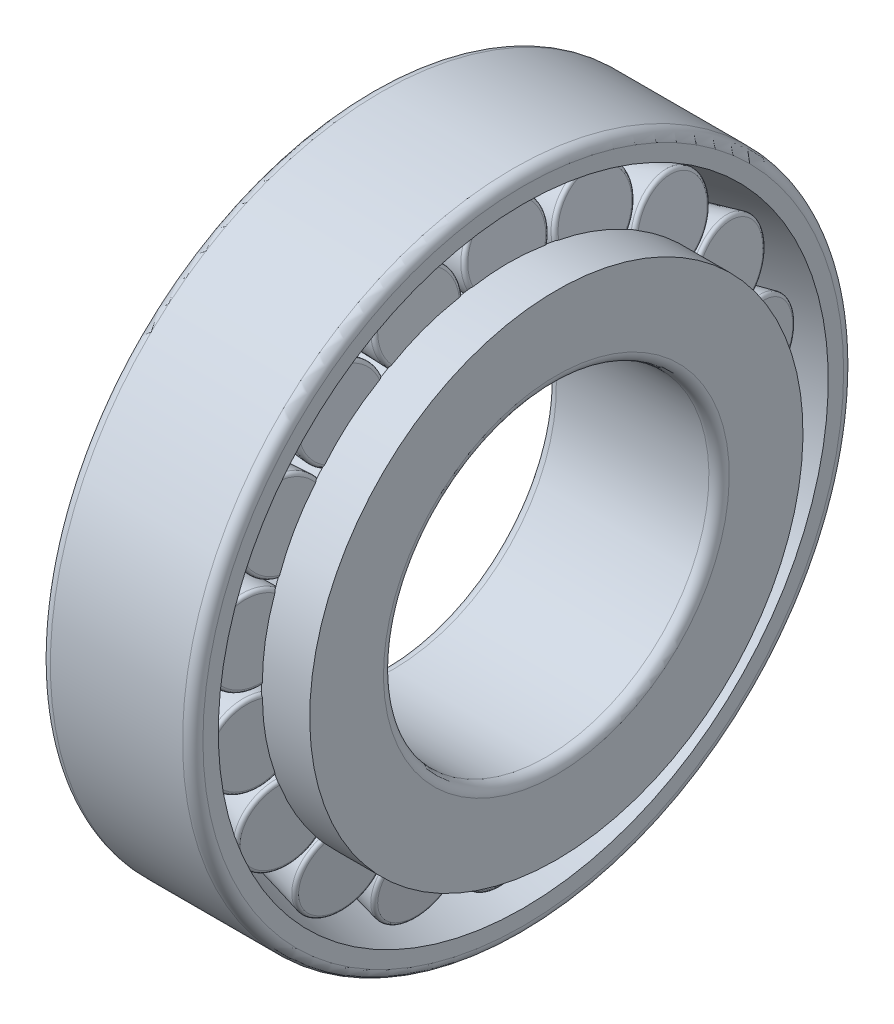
SolidWorks part; units mm, degrees
ref_plane "Front" through (0, 0, 0) normal (0, 0, 1) x (1, 0, 0)
ref_plane "Top" through (0, 0, 0) normal (0, 1, 0) x (1, 0, 0)
ref_plane "Right" through (0, 0, 0) normal (1, 0, 0) x (0, 0, -1)
other "Configuration Table"
sketch "Sketch1" plane through (0, 0, 0) normal (0, 0, 1) x (1, 0, 0)
  line L0 (10.753, 0) -> (13.9916, 0) construction
  line L1 (7.5, 29.9899) -> (7.5, 31.5)
  line L2 (6.5, 32.5) -> (-6.5, 32.5)
  line L3 (-7.5, 31.5) -> (-7.5, 26.25)
  line L4 (-7.5, 26.25) -> (7.5, 29.9899)
  line L5 (-6.247, 17) -> (-6.247, 22.0124)
  line L6 (-5.247, 16) -> (9.753, 16)
  line L7 (10.753, 17) -> (10.753, 24.2704)
  line L8 (-4.3401, 20.5124) -> (-5.3344, 26.79)
  line L9 (6.5, 21.2704) -> (5.2094, 29.4188)
  line L10 (-4.8372, 23.6512) -> (5.8547, 25.3446) construction
  line L11 (-4.3401, 20.5124) -> (6.5, 21.2704)
  line L12 (6.0248, 24.25) -> (10.753, 24.25)
  line L13 (10.753, 24.2704) -> (6.0248, 24.2704)
  line L14 (-6.247, 22.0124) -> (-4.5777, 22.0124)
  arc A0 (-6.5, 32.5) -> (-7.5, 31.5) centre (-6.5, 31.5) ccw
  arc A1 (7.5, 31.5) -> (6.5, 32.5) centre (6.5, 31.5) ccw
  arc A2 (-5.247, 16) -> (-6.247, 17) centre (-5.247, 17) cw
  arc A3 (9.753, 16) -> (10.753, 17) centre (9.753, 17) ccw
  point P19 (-7.5, 32.5)
  point P22 (7.5, 32.5)
  point P24 (0, 32.5)
  point P29 (-6.247, 16)
  point P32 (10.753, 16)
revolve "Revolve1" add sketch "Sketch1" angle 360 about L0
sketch "Sketch2" plane through (0, 0, 0) normal (0, 0, 1) x (1, 0, 0)
  line L0 (-4.857, 23.648) -> (9.3992, 25.906) construction
  line L4 (-4.8372, 23.6512) -> (5.8547, 25.3446) construction
  line L5 (-4.857, 23.648) -> (5.8745, 25.3477)
  line L7 (-5.3541, 26.7868) -> (-4.357, 20.4911)
  line L8 (6.5232, 21.252) -> (5.2292, 29.4219)
  line L9 (-4.357, 20.4911) -> (6.5232, 21.252)
  line L10 (-4.857, 23.648) -> (-4.4043, 20.7898)
  line L11 (6.4668, 21.6077) -> (5.8745, 25.3477)
  line L12 (-4.0553, 20.5122) -> (6.1639, 21.2268)
  arc A0 (-4.0553, 20.5122) -> (-4.4043, 20.7898) centre (-4.0783, 20.8414) cw
  arc A1 (6.1639, 21.2268) -> (6.4668, 21.6077) centre (6.1409, 21.556) ccw
revolve "Revolve2" add sketch "Sketch2" angle 360 about L0
sketch "Sketch3" plane through (0, 0, 0) normal (0, 0, 1) x (1, 0, 0)
  line L0 (-7.5, 26.25) -> (7.5, 29.9899) construction
  line L1 (-7.5, 31.5) -> (-7.5, 26.25) construction
  line L2 (6.5, 32.5) -> (-6.5, 32.5) construction
  line L3 (7.5, 29.9899) -> (7.5, 31.5) construction
  line L4 (-7.5, 26.25) -> (7.5, 29.9899)
  line L5 (-7.5, 31.5) -> (-7.5, 26.25)
  line L6 (6.5, 32.5) -> (-6.5, 32.5)
  line L7 (7.5, 29.9899) -> (7.5, 31.5)
  arc A0 (-6.5, 32.5) -> (-7.5, 31.5) centre (-6.5, 31.5) ccw construction
  arc A1 (7.5, 31.5) -> (6.5, 32.5) centre (6.5, 31.5) ccw construction
  arc A2 (-6.5, 32.5) -> (-7.5, 31.5) centre (-6.5, 31.5) ccw
  arc A3 (7.5, 31.5) -> (6.5, 32.5) centre (6.5, 31.5) ccw
revolve "Revolve3" add sketch "Sketch3" angle 360 about axis through (10.753, 0, 0) along (1, 0, 0)
pattern_circular "Circular-Pattern1" count 18 over 360 about axis through (0, 0, 0) along (1, 0, 0) of "Revolve2"
equation "\"gzzj@Sketch1\" =  ( \"DD@Sketch1\" - \"XD@Sketch1\" )  / 4"
equation "\"D1@Sketch1\" = \"DB@Sketch1\" - \"DT@Sketch1\" / 20"
equation "\"D2@Sketch1\" = \"DT@Sketch1\" - \"DC@Sketch1\" + \"XR12@Sketch1\""
equation "\"D4@Sketch1\" = \"D3@Sketch1\" / 2"
equation "\"D2@Sketch2\" = \"gzzj@Sketch1\" / 25"
equation "\"ZJ@Sketch1\" =  ( \"DD@Sketch1\" + \"XD@Sketch1\" )  / 2"
equation "\"D1@Circular-Pattern1\" = int( 3.14159265 / atn(( \"gzzj@Sketch1\" / 2) / sqr( \"ZJ@Sketch1\" * \"ZJ@Sketch1\" /4 - ( \"gzzj@Sketch1\"/ 2) *  ( \"gzzj@Sketch1\"/ 2))))"
